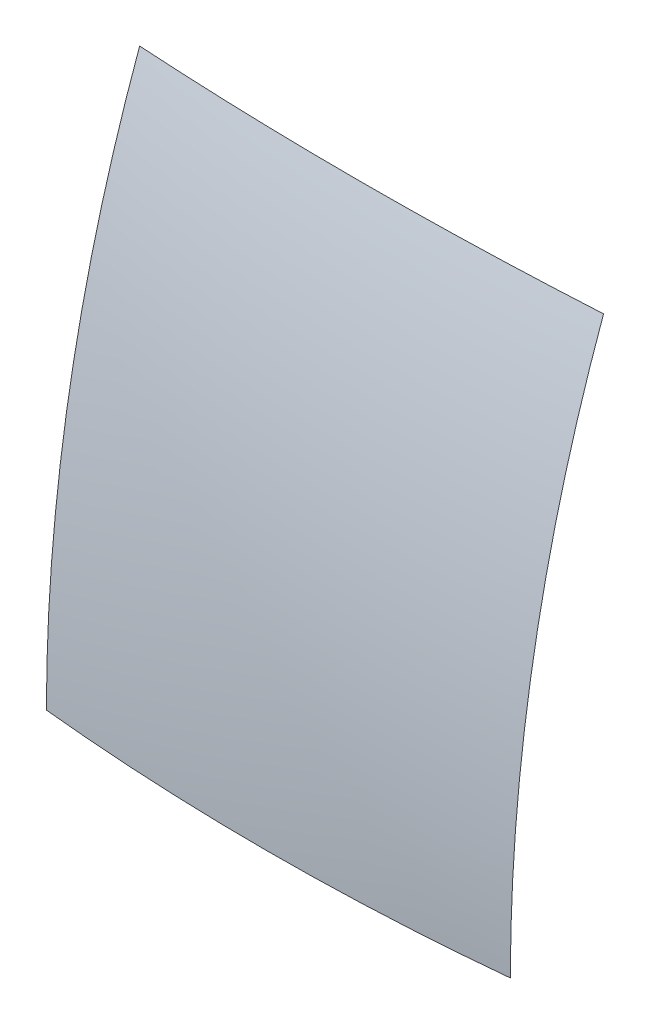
SolidWorks part; units mm, degrees
ref_plane "Front Plane" through (0, 0, 0) normal (0, 0, 1) x (1, 0, 0)
ref_plane "Top Plane" through (0, 0, 0) normal (0, 1, 0) x (1, 0, 0)
ref_plane "Right Plane" through (0, 0, 0) normal (1, 0, 0) x (0, 0, -1)
sketch "Sketch1" plane through (0, 0, 0) normal (0, 1, 0) x (1, 0, 0)
  line L0 (-76.25, -38) -> (76.25, -38) construction
  line L1 (0, 725.1082) -> (0, -38) construction
  line L2 (-101.9654, 470) -> (64.5631, 470) construction
  arc A0 (-76.25, -38) -> (76.25, -38) centre (0, 725.1082) ccw
  dimension "D1" = 38
  dimension "D2" = 3.8
  dimension "D3" = 152.5
  dimension "D4" = 508
surface "Surface-Revolve1" sketch "Sketch1" parameters "D1"=20
